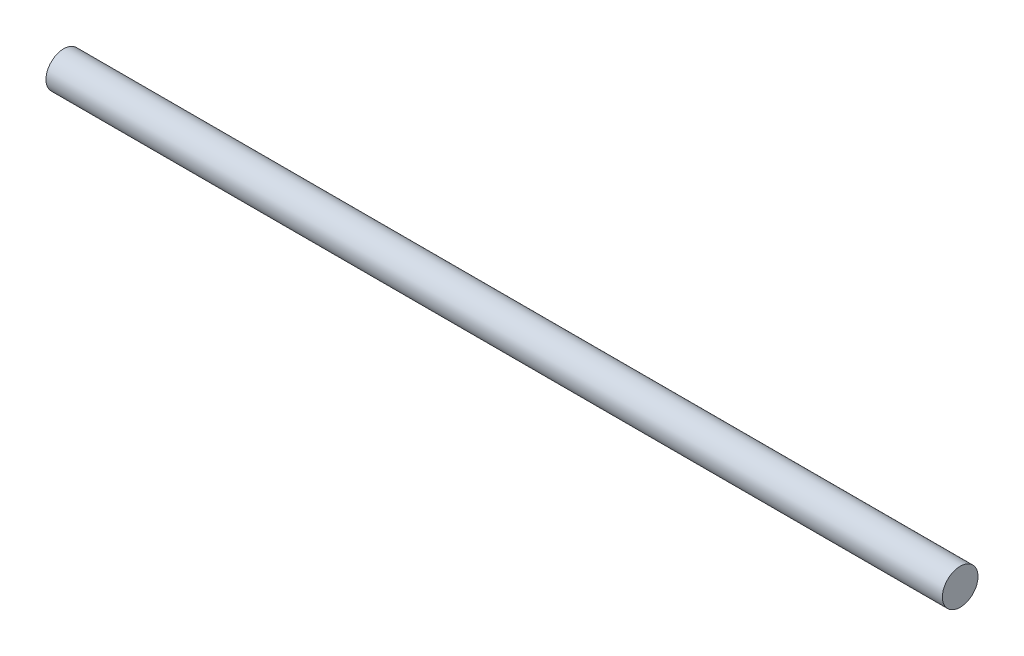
SolidWorks part; units mm, degrees
ref_plane "Front Plane" through (0, 0, 0) normal (0, 0, 1) x (1, 0, 0)
ref_plane "Top Plane" through (0, 0, 0) normal (0, 1, 0) x (1, 0, 0)
ref_plane "Right Plane" through (0, 0, 0) normal (1, 0, 0) x (0, 0, -1)
sketch "Sketch1" plane through (0, 0, 0) normal (1, 0, 0) x (0, 0, -1)
  circle A0 centre (0, 0) radius 3
  dimension "D1" = 6
extrude "Boss-Extrude1" add sketch "Sketch1" along normal blind 151
